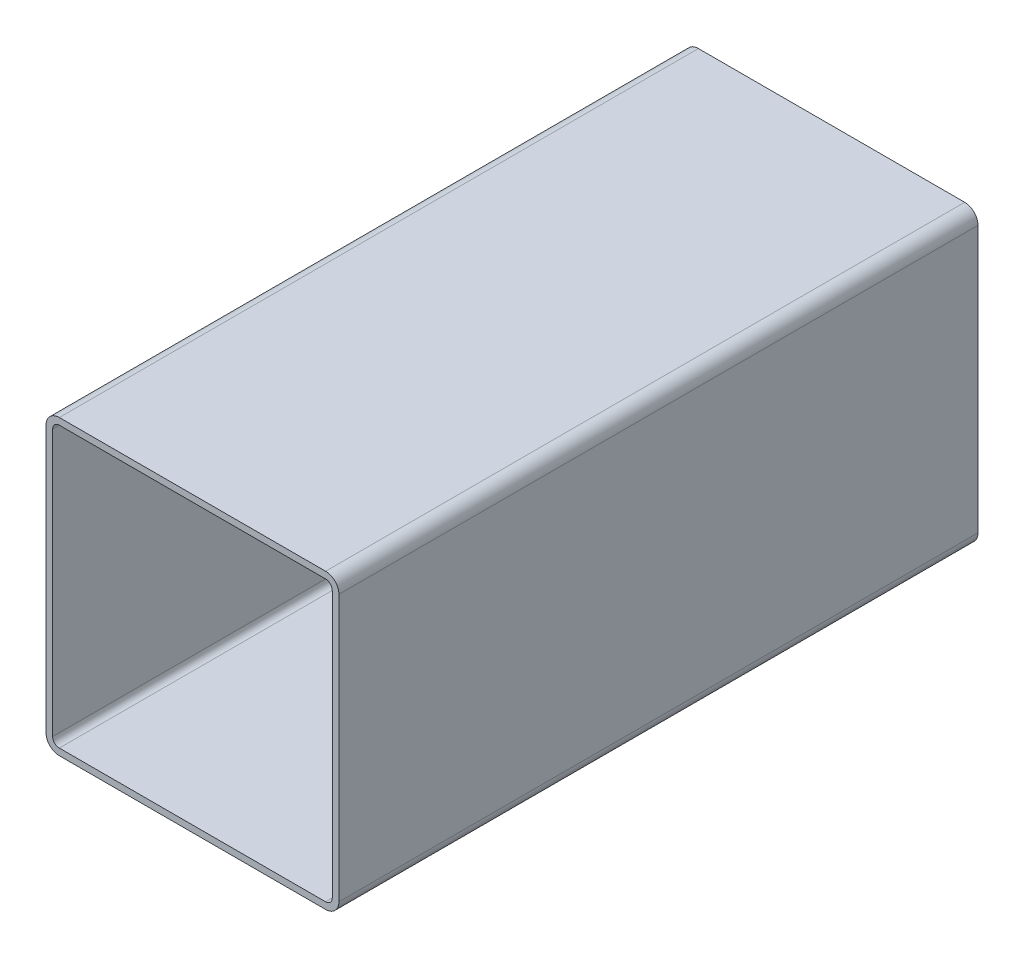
SolidWorks part; units mm, degrees
ref_plane "Front Plane" through (0, 0, 0) normal (0, 0, 1) x (1, 0, 0)
ref_plane "Top Plane" through (0, 0, 0) normal (0, 1, 0) x (1, 0, 0)
ref_plane "Right Plane" through (0, 0, 0) normal (1, 0, 0) x (0, 0, -1)
sketch "Sketch1" plane through (0, 0, 0) normal (0, 0, 1) x (1, 0, 0)
sketch_block_instance "HSS5.5x5.5x0.125-1"
sketch_block "HSS5.5x5.5x0.125"
extrude "Boss-Extrude1" add sketch "Sketch1" along normal blind 304.8
